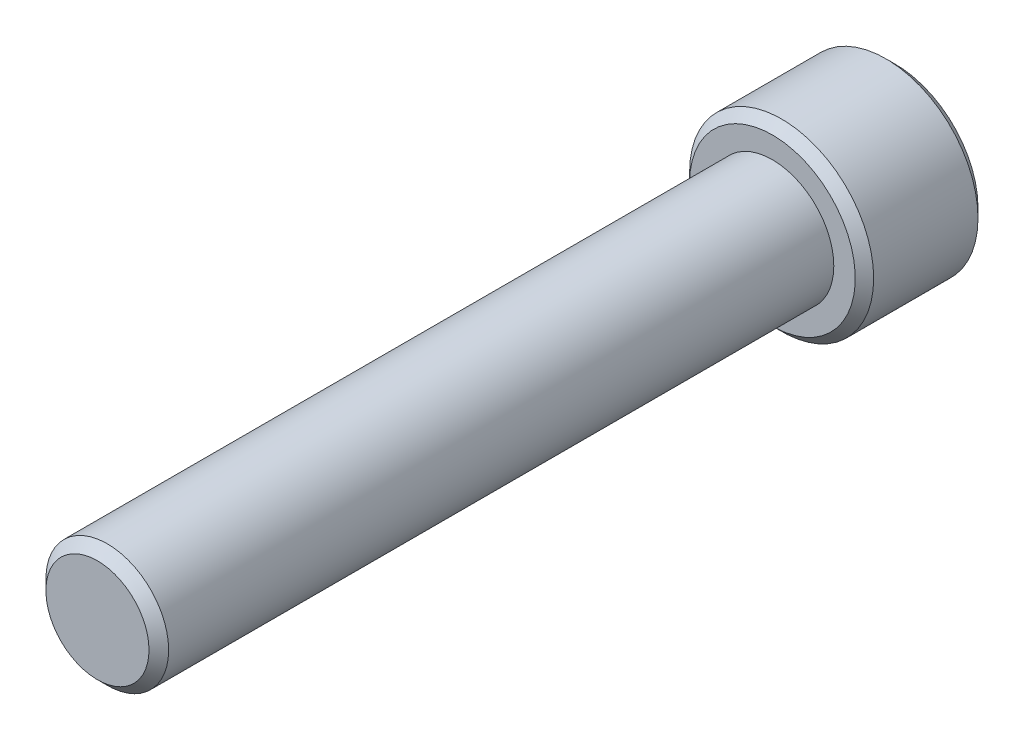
SolidWorks part; units mm, degrees
ref_plane "Front Plane" through (0, 0, 0) normal (0, 0, 1) x (1, 0, 0)
ref_plane "Top Plane" through (0, 0, 0) normal (0, 1, 0) x (1, 0, 0)
ref_plane "Right Plane" through (0, 0, 0) normal (1, 0, 0) x (0, 0, -1)
sketch "Sketch1" plane through (0, 0, 0) normal (0, 0, 1) x (1, 0, 0)
  circle A0 centre (0, 0) radius 3.175
  dimension "OD" = 6.35
extrude "Extrude1" add sketch "Sketch1" against normal blind 34.925
sketch "Sketch6" plane through (0, 0, -34.925) normal (0, 0, -1) x (-1, 0, 0)
  circle A0 centre (0, 0) radius 4.7625
  dimension "head dia" = 9.525
extrude "Extrude2" add sketch "Sketch6" along normal blind 6.35
sketch "Sketch7" plane through (0, 0, -41.275) normal (0, 0, -1) x (-1, 0, 0)
  line L1 (0, 2.7496) -> (-2.3812, 1.3748)
  line L2 (-2.3812, 1.3748) -> (-2.3812, -1.3748)
  line L3 (-2.3812, -1.3748) -> (0, -2.7496)
  line L4 (0, -2.7496) -> (2.3813, -1.3748)
  line L5 (2.3813, -1.3748) -> (2.3813, 1.3748)
  line L6 (2.3813, 1.3748) -> (0, 2.7496)
  circle A0 centre (0, 0) radius 2.3813 construction
  dimension "hex dia" = 4.7625
extrude "Cut-Extrude1" cut sketch "Sketch7" against normal blind 3.5719
sketch "Sketch8" plane through (0, 0, -41.275) normal (0, 0, -1) x (-1, 0, 0)
  circle A0 centre (0, 0) radius 2.7496
extrude "Cut-Extrude2" cut sketch "Sketch8" against normal through all draft 45
chamfer "Chamfer1" distance 0.4763 angle 45 2 edges at (-4.7625, 0, -41.275) (-4.7625, 0, -34.925)
chamfer "Chamfer2" distance 0.508 angle 45 1 edges at (3.175, 0, 0)
